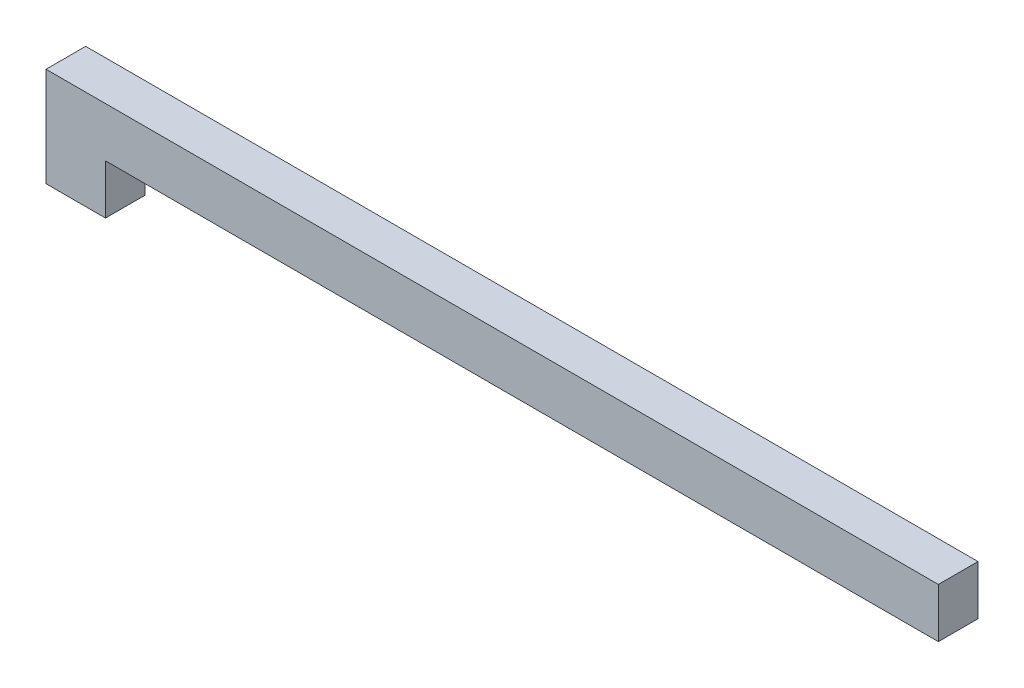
SolidWorks part; units mm, degrees
ref_plane "Front Plane" through (0, 0, 0) normal (0, 0, 1) x (1, 0, 0)
ref_plane "Top Plane" through (0, 0, 0) normal (0, 1, 0) x (1, 0, 0)
ref_plane "Right Plane" through (0, 0, 0) normal (1, 0, 0) x (0, 0, -1)
sketch "Sketch1" plane through (0, 0, 0) normal (0, 0, 1) x (1, 0, 0)
  line L0 (0, 0) -> (0, -2.5)
  line L1 (0, -2.5) -> (-3, -2.5)
  line L2 (-3, -2.5) -> (-3, 2.5)
  line L3 (-3, 2.5) -> (42, 2.5)
  line L4 (42, 2.5) -> (42, 0)
  line L5 (42, 0) -> (0, 0)
  dimension "D1" = 5
  dimension "D2" = 45
  dimension "D3" = 2.5
  dimension "D4" = 2.5
  dimension "D5" = 3
extrude "Boss-Extrude1" add sketch "Sketch1" along normal blind 2
